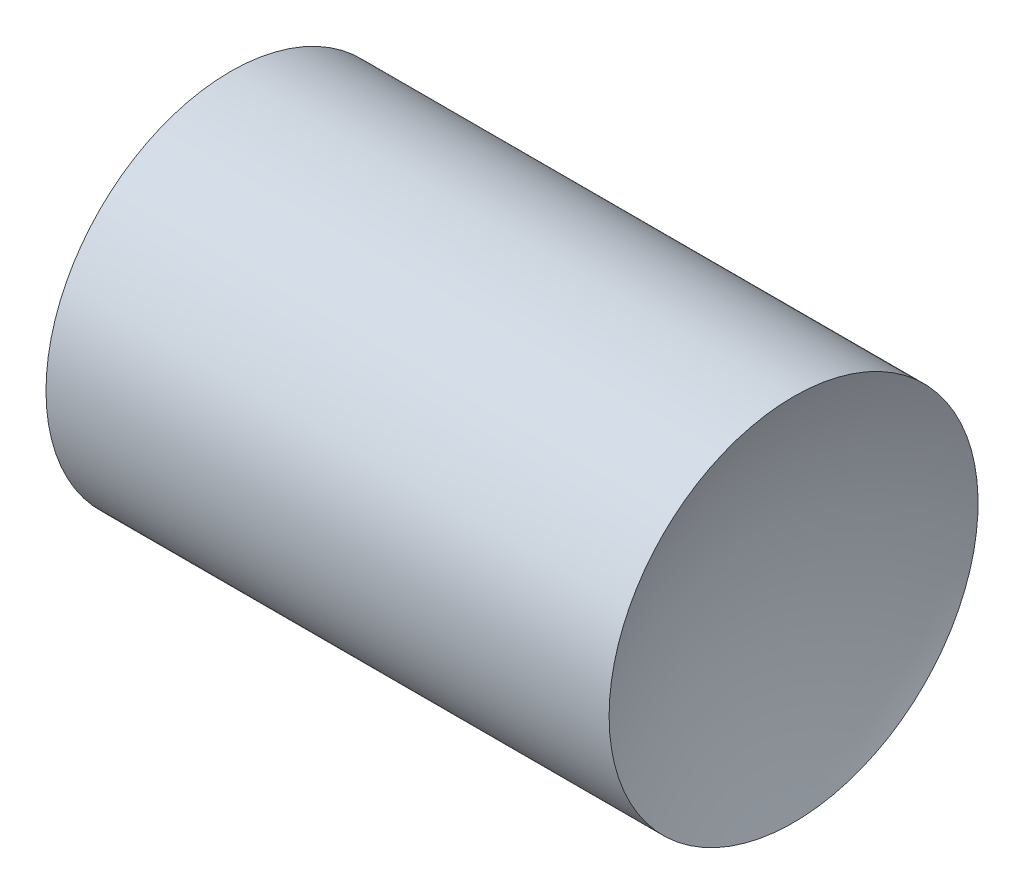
SolidWorks part; units mm, degrees
ref_plane "Vorne" through (0, 0, 0) normal (0, 0, 1) x (1, 0, 0)
ref_plane "Oben" through (0, 0, 0) normal (0, 1, 0) x (1, 0, 0)
ref_plane "Rechts" through (0, 0, 0) normal (1, 0, 0) x (0, 0, -1)
ref_plane "Ebene1" through (0, 0, 8) normal (0, 0, 1) x (1, 0, 0)
sketch "Skizze1" plane through (0, 0, 8) normal (0, 0, 1) x (1, 0, 0)
  line L0 (11.7447, 2.5) -> (23.1101, 2.5) construction
  line L1 (0, 0) -> (113.9649, 0) construction
  line L2 (11.7447, 2.5) -> (19.3754, 2.5)
  line L3 (0, 0) -> (113.9649, 0) construction
  line L4 (11.48, 0) -> (18.835, 0)
  arc A0 (11.7447, 2.5) -> (11.48, 0) centre (23.42, 0) ccw construction
  arc A1 (19.3754, 2.5) -> (18.835, 0) centre (24.8875, 0) ccw construction
  arc A3 (11.7447, 2.5) -> (11.48, 0) centre (23.42, 0) ccw
  arc A4 (19.3754, 2.5) -> (18.835, 0) centre (24.8875, 0) ccw
revolve "Rotation1" add sketch "Skizze1" angle 360 about L3
